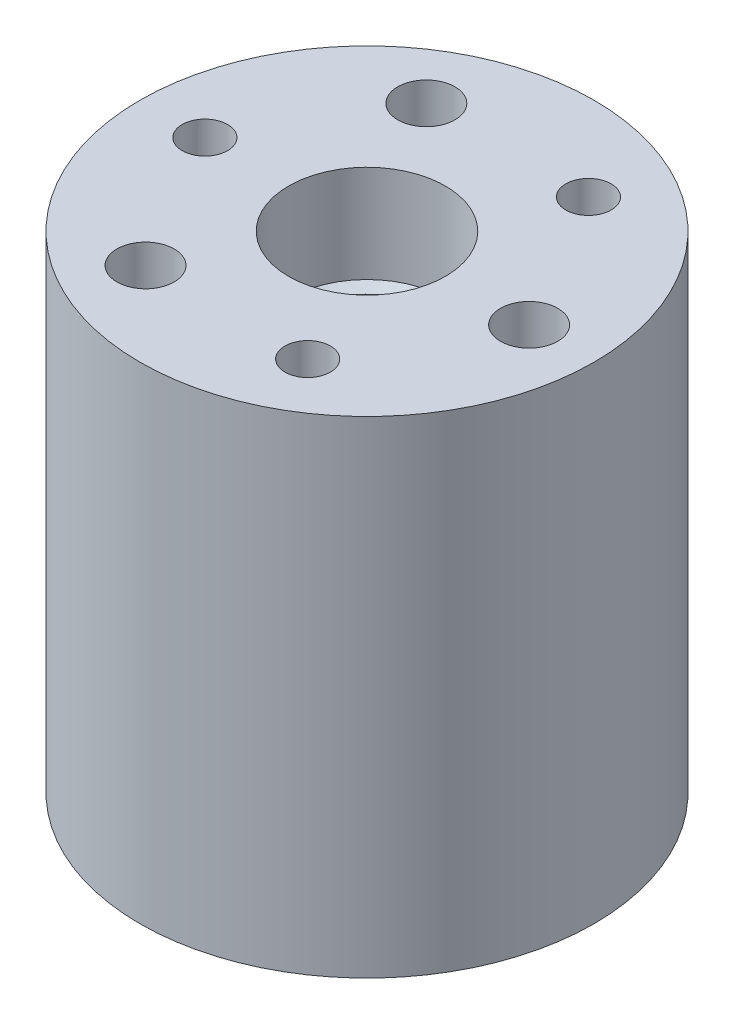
SolidWorks part; units mm, degrees
ref_plane "Front" through (0, 0, 0) normal (0, 0, 1) x (1, 0, 0)
ref_plane "Top" through (0, 0, 0) normal (0, 1, 0) x (1, 0, 0)
ref_plane "Right" through (0, 0, 0) normal (1, 0, 0) x (0, 0, -1)
ref_axis "Axis2" through (0, 15.132, 0) along (0, -1, 0)
sketch "Sketch1" plane through (0, 0, 0) normal (0, 1, 0) x (1, 0, 0)
  circle A0 centre (0, 0) radius 21 construction
  circle A1 centre (0, 0) radius 15 construction
  circle A5 centre (15, 0) radius 2.5 construction
  circle A6 centre (0, 0) radius 6.35 construction
  circle A7 centre (0, 0) radius 8 construction
  point P4 (15, 0)
  point P5 (-15, 0)
  dimension "D1" = 30
  dimension "D2" = 42
  dimension "D3" = 5
  dimension "D4" = 12.7
  dimension "D5" = 16
sketch "Sketch2" plane through (0, 0, 0) normal (0, 1, 0) x (1, 0, 0)
  circle A0 centre (0, 0) radius 21 construction
  circle A1 centre (0, 0) radius 21
extrude "Boss-Extrude1" add sketch "Sketch2" against normal blind 45
hole_wizard "1/8 (0.125) Diameter Hole1" positions "Sketch8" profile "Sketch9" hole size "1/8" standard "ANSI Inch"
sketch "Sketch8" plane through (0, 0, 0) normal (0, 1, 0) x (1, 0, 0)
  point P0 (0, 0)
sketch "Sketch9" plane through (0, 0, 0) normal (1, 0, 0) x (0, 0, 1)
  line L0 (0, 0) -> (0, 45)
  line L1 (0, 45) -> (1.5875, 45)
  line L2 (1.5875, 45) -> (1.5875, 0)
  line L5 (1.5875, 0) -> (0, 0)
  line L11 (0, -6.35) -> (0, 107.95) construction
  dimension "Thru Hole Dia." = 3.175
  dimension "Thru Hole Depth" = 45
sketch "Sketch10" plane through (0, 0, 0) normal (0, 1, 0) x (1, 0, 0)
  circle A0 centre (0, 0) radius 6.35 construction
  circle A1 centre (0, 0) radius 6.35
extrude "Cut-Extrude2" cut sketch "Sketch10" against normal blind 36
hole_wizard "M16x1.5 Tapped Hole1" positions "Sketch11" profile "Sketch12" tap size "M16x1.5" standard "ANSI Metric"
sketch "Sketch11" plane through (0, 0, 0) normal (0, 1, 0) x (1, 0, 0)
  point P0 (0, 0)
sketch "Sketch12" plane through (0, 0, 0) normal (1, 0, 0) x (0, 0, 1)
  line L0 (0, 0) -> (0, 13.3562)
  line L1 (0, 13.3562) -> (7.25, 9)
  line L2 (7.25, 9) -> (7.25, 0)
  line L5 (7.25, 0) -> (0, 0)
  line L10 (0, 13.3562) -> (-7.25, 9) construction
  line L11 (0, -6.35) -> (0, 107.95) construction
  dimension "Tap Drill Dia." = 14.5
  dimension "Tap Drill Depth" = 9
  dimension "Drill Angle" = 118
sketch "Sketch3" plane through (0, 0, 0) normal (0, 1, 0) x (1, 0, 0)
  circle A0 centre (15, 0) radius 2.5 construction
  circle A1 centre (15, 0) radius 2.5
extrude "Cut-Extrude1" [suppressed] cut sketch "Sketch3" against normal up to next
pattern_circular "CirPattern1" [suppressed] count 3 over 360 about axis through (0, 15.132, 0) along (0, -1, 0)
hole_wizard "M5 Clearance Hole1" positions "Sketch4" profile "Sketch5" hole size "M5" standard "ANSI Metric"
sketch "Sketch4" plane through (0, 0, 0) normal (0, 1, 0) x (1, 0, 0)
  point P0 (15, 0)
sketch "Sketch5" plane through (15, 0, 0) normal (1, 0, 0) x (0, 0, 1)
  line L0 (0, 0) -> (0, 45.001)
  line L1 (0, 45.001) -> (2.65, 45.001)
  line L2 (2.65, 45.001) -> (2.65, 0)
  line L5 (2.65, 0) -> (0, 0)
  line L11 (0, -6.35) -> (0, 107.95) construction
  dimension "Thru Hole Dia." = 5.3
  dimension "Thru Hole Depth" = 45.001
pattern_circular "CirPattern2" count 3 over 360 about axis through (0, 0, 0) along (0, 1, 0) of "M5 Clearance Hole1"
hole_wizard "M5x0.8 Tapped Hole1" positions "Sketch6" profile "Sketch7" tap size "M5x0.8" standard "ANSI Metric"
sketch "Sketch6" plane through (0, 0, 0) normal (0, 1, 0) x (1, 0, 0)
  point P0 (-15, 0)
sketch "Sketch7" plane through (-15, 0, 0) normal (1, 0, 0) x (0, 0, 1)
  line L0 (0, 0) -> (0, 19.2618)
  line L1 (0, 19.2618) -> (2.1, 18)
  line L2 (2.1, 18) -> (2.1, 0)
  line L5 (2.1, 0) -> (0, 0)
  line L10 (0, 19.2618) -> (-2.1, 18) construction
  line L11 (0, -6.35) -> (0, 107.95) construction
  dimension "Tap Drill Dia." = 4.2
  dimension "Tap Drill Depth" = 18
  dimension "Drill Angle" = 118
pattern_circular "CirPattern3" count 3 over 360 about axis through (0, 0, 0) along (0, 1, 0) of "M5x0.8 Tapped Hole1"
sketch "Sketch17" plane through (0, -45, 0) normal (0, -1, 0) x (1, 0, 0)
  circle A0 centre (0, 0) radius 8 construction
  circle A1 centre (0, 0) radius 8
extrude "Cut-Extrude3" cut sketch "Sketch17" against normal blind 2
sketch "Sketch18" plane through (0, 0, 0) normal (1, 0, 0) x (0, 0, -1)
  line L0 (-8, -43) -> (8, -43) construction
  line L1 (-4.2672, -43) -> (-6.4008, -43)
  line L2 (-4.2672, -43) -> (-4.2672, -41.6792)
  line L3 (-4.2672, -41.6792) -> (-6.4008, -41.6792)
  line L4 (-6.4008, -43) -> (-6.4008, -41.6792)
  line L5 (-4.2672, -43) -> (-6.4008, -41.6792) construction
  line L6 (-4.2672, -41.6792) -> (-6.4008, -43) construction
  line L7 (0, 15.132) -> (0, -50) construction
  line L9 (-21, -45) -> (21, -45) construction
  point P4 (-5.334, -42.3396)
  dimension "D1" = 2.1336
  dimension ".504/2\"" = 6.4008
  dimension "D3" = 2
  dimension "D4" = 1.3208
sketch "Sketch19" plane through (0, 0, 0) normal (1, 0, 0) x (0, 0, -1)
  line L4 (-6.4008, -43) -> (-4.2672, -43)
  line L5 (-6.4008, -41.6792) -> (-6.4008, -43)
  line L6 (-4.2672, -41.6792) -> (-6.4008, -41.6792)
  line L7 (-4.2672, -43) -> (-4.2672, -41.6792)
  line L8 (-6.4008, -43) -> (-4.2672, -43)
  line L9 (-6.4008, -41.6792) -> (-6.4008, -43)
  line L10 (-4.2672, -41.6792) -> (-6.4008, -41.6792)
  line L11 (-4.2672, -43) -> (-4.2672, -41.6792)
  dimension "D1" = 0
revolve "Cut-Revolve1" cut sketch "Sketch19" angle 360 about axis through (0, 15.132, 0) along (0, -1, 0)
ref_plane "Plane1" through (0, -38.5, 0) normal (0, 1, 0) x (1, 0, 0)
ref_axis "Axis1" through (22.8907, -38.5, 0) along (-1, 0, 0)
ref_plane "Plane2" through (-21, 0, 0) normal (-1, 0, 0) x (0, 0, 1)
hole_wizard "1/16 (0.0625) Diameter Hole1" positions "Sketch14" profile "Sketch15" hole size "1/16" standard "ANSI Inch"
sketch "Sketch14" plane through (-21, 0, 0) normal (-1, 0, 0) x (0, 0, 1)
  point P0 (0, -38.5)
sketch "Sketch15" plane through (-21, -38.5, 0) normal (0, 1, 0) x (0, 0, 1)
  line L0 (0, 0) -> (0, 20.4769)
  line L1 (0, 20.4769) -> (0.7937, 20)
  line L2 (0.7937, 20) -> (0.7937, 0)
  line L5 (0.7937, 0) -> (0, 0)
  line L10 (0, 20.4769) -> (-0.7938, 20) construction
  line L11 (0, -6.35) -> (0, 107.95) construction
  dimension "Hole Dia." = 1.5875
  dimension "Hole Depth" = 20
  dimension "Drill Angle" = 118
hole_wizard "#10-32 Tapped Hole1" positions "Sketch20" profile "Sketch21" tap size "#10-32" standard "ANSI Inch"
sketch "Sketch20" plane through (-21, 0, 0) normal (-1, 0, 0) x (0, 0, 1)
  point P0 (0, -38.5)
sketch "Sketch21" plane through (-21, -38.5, 0) normal (0, 1, 0) x (0, 0, 1)
  line L0 (0, 0) -> (0, 7.5125)
  line L1 (0, 7.5125) -> (2.0193, 6.2992)
  line L2 (2.0193, 6.2992) -> (2.0193, 0)
  line L5 (2.0193, 0) -> (0, 0)
  line L10 (0, 7.5125) -> (-2.0193, 6.2992) construction
  line L11 (0, -6.35) -> (0, 107.95) construction
  dimension "Tap Drill Dia." = 4.0386
  dimension "Tap Drill Depth" = 6.2992
  dimension "Drill Angle" = 118
sketch "Sketch22" plane through (0, 0, 0) normal (0, 0, 1) x (1, 0, 0)
  line L0 (-12.316, -39.3509) -> (-21, -42.5116) construction
  line L5 (50, -38.5) -> (-50, -38.5) construction
  line L6 (-10.586, -39.3509) -> (-12.316, -39.3509) construction
  line L7 (-12.316, -37.6491) -> (-21, -34.4884) construction
  line L8 (-10.586, -39.3509) -> (-10.586, -37.6491) construction
  line L9 (-10.586, -37.6491) -> (-12.316, -37.6491) construction
  line L12 (-12.316, -39.3509) -> (-12.316, -37.6491) construction
  line L13 (-10.586, -39.3509) -> (-12.316, -37.6491) construction
  line L14 (-10.586, -37.6491) -> (-12.316, -39.3509) construction
  line L15 (-21, 22) -> (-21, -22) construction
  line L16 (-14.65, -36.7996) -> (-14.65, -40.2004) construction
  circle A0 centre (-13.4594, -38.5) radius 1.1906 construction
  point P0 (-11.451, -38.5)
  dimension "D3" = 2.3813
  dimension "D6" = 4.064
  dimension "D1" = 40
  dimension "D2" = 20
  dimension "D4" = 10.414
  dimension "D5" = 1.7018
sketch "Sketch23" plane through (0, 0, 0) normal (0, 0, 1) x (1, 0, 0)
  line L0 (-14.65, -36.7996) -> (-14.65, -40.2004) construction
  line L1 (-10.586, -39.3509) -> (-10.586, -37.6491) construction
  line L2 (-10.586, -37.6491) -> (-12.316, -37.6491) construction
  line L3 (-12.316, -37.6491) -> (-21, -34.4884) construction
  line L4 (-14.65, -36.7996) -> (-14.65, -38.5)
  line L5 (-10.586, -38.5) -> (-10.586, -37.6491)
  line L6 (-10.586, -37.6491) -> (-12.316, -37.6491)
  line L7 (-12.316, -37.6491) -> (-14.65, -36.7996)
  line L8 (-14.65, -38.5) -> (-10.586, -38.5)
  line L9 (22.8907, -38.5) -> (-27.5817, -38.5) construction
revolve "Cut-Revolve2" cut sketch "Sketch23" angle 360 about axis through (22.8907, -38.5, 0) along (-1, 0, 0)
chamfer "Chamfer1" distance 0.5 angle 45 1 edges at (0, -45, -8)
